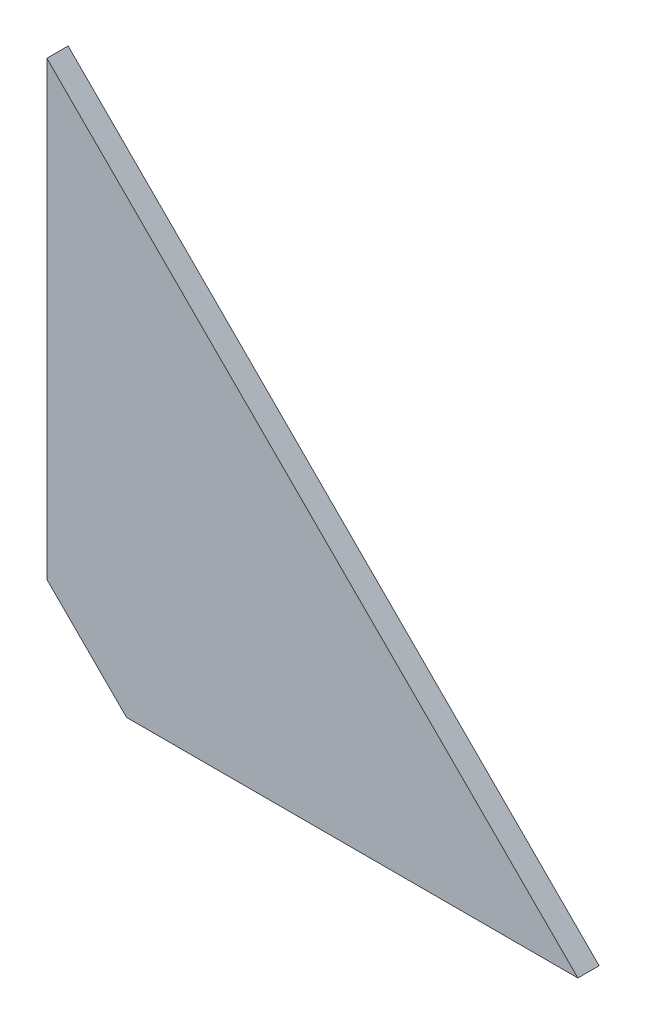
SolidWorks part; units mm, degrees
ref_plane "Plan1" through (0, 0, 0) normal (0, 0, 1) x (1, 0, 0)
ref_plane "Plan2" through (0, 0, 0) normal (0, 1, 0) x (1, 0, 0)
ref_plane "Plan3" through (0, 0, 0) normal (1, 0, 0) x (0, 0, -1)
sketch "Esquisse1" plane through (0, 0, 0) normal (0, 0, 1) x (1, 0, 0)
  line L0 (0, 200) -> (200, 0)
  line L1 (30, 0) -> (200, 0)
  line L2 (0, 30) -> (0, 200)
  line L5 (30, 0) -> (0, 30)
extrude "Base-Extrusion" add sketch "Esquisse1" along normal blind 8
